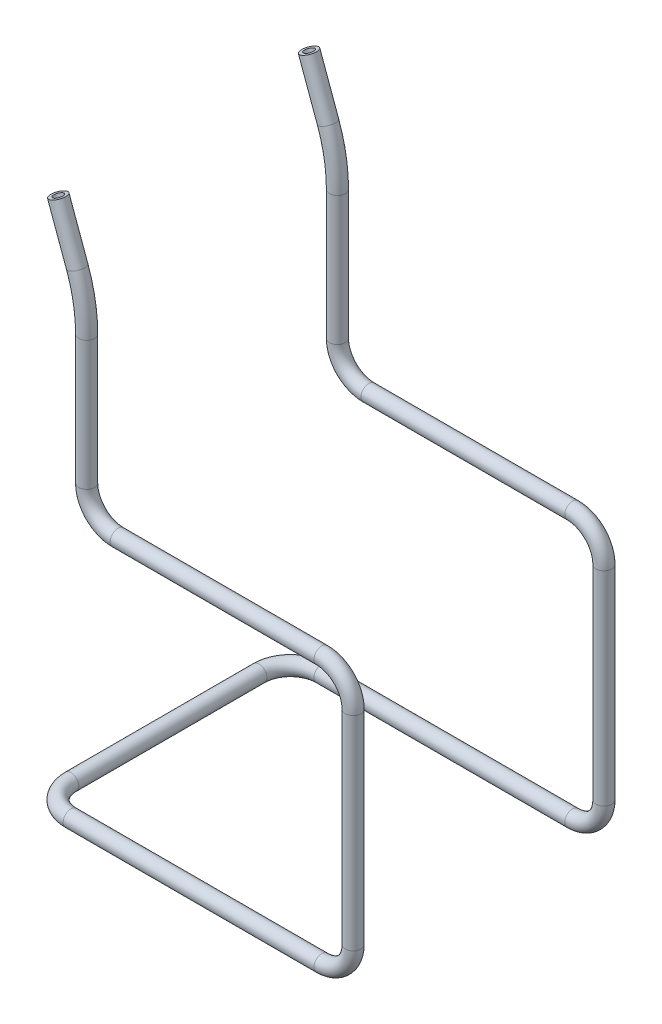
SolidWorks part; units mm, degrees
ref_plane "Front Plane" through (0, 0, 0) normal (0, 0, 1) x (1, 0, 0)
ref_plane "Top Plane" through (0, 0, 0) normal (0, 1, 0) x (1, 0, 0)
ref_plane "Right Plane" through (0, 0, 0) normal (1, 0, 0) x (0, 0, -1)
ref_plane "Plane1" through (0, 0, 40) normal (0, 0, 1) x (1, 0, 0)
sketch3d "3DSketch2"
  line L0 (0, 0, 0) -> (0, 0, 30)
  line L1 (10, 0, 40) -> (90, 0, 40)
  line L2 (100, 10, 40) -> (100, 75, 40)
  line L3 (90, 85, 40) -> (25, 85, 40)
  line L4 (15, 95, 40) -> (15, 136.1781, 40)
  line L5 (11.9846, 153.2791, 40) -> (5.9365, 169.8963, 40)
  arc A0 (100, 75, 40) -> (90, 85, 40) centre (90, 75, 40) ccw
  arc A1 (90, 0, 40) -> (100, 10, 40) centre (90, 10, 40) ccw
  arc A2 (0, 0, 30) -> (10, 0, 40) centre (10, 0, 30) ccw
  arc A3 (15, 136.1781, 40) -> (11.9846, 153.2791, 40) centre (-35, 136.1781, 40) ccw
  arc A4 (25, 85, 40) -> (15, 95, 40) centre (25, 95, 40) ccw
  point P10 (100, 85, 40)
  point P11 (90, 75, 50)
  point P14 (100, 0, 40)
  point P15 (90, 10, 50)
  point P18 (0, 0, 40)
  point P19 (10, 10, 30)
  point P22 (15, 144.9945, 40)
  point P23 (-35, 136.1781, 90)
  point P26 (15, 85, 40)
  point P27 (25, 95, 30)
  dimension "D1" = 10
  dimension "D2" = 50
  dimension "D6" = 10
  dimension "D3" = 40
  dimension "D4" = 100
  dimension "D5" = 85
  dimension "D7" = 85
  dimension "D8" = 26.5
  dimension "D9" = 20
  dimension "D10" = 170
sketch "Sketch1" plane through (0, 0, 0) normal (0, 0, 1) x (1, 0, 0)
  circle A0 centre (0, 0) radius 2.5
  dimension "D1" = 5
sweep "Sweep-Thin1" add profiles "Sketch1" path "3DSketch2" parameters "D1"=1
mirror "Mirror1" about plane through (0, 0, 0) normal (0, 0, 1) of "Sweep-Thin1"
